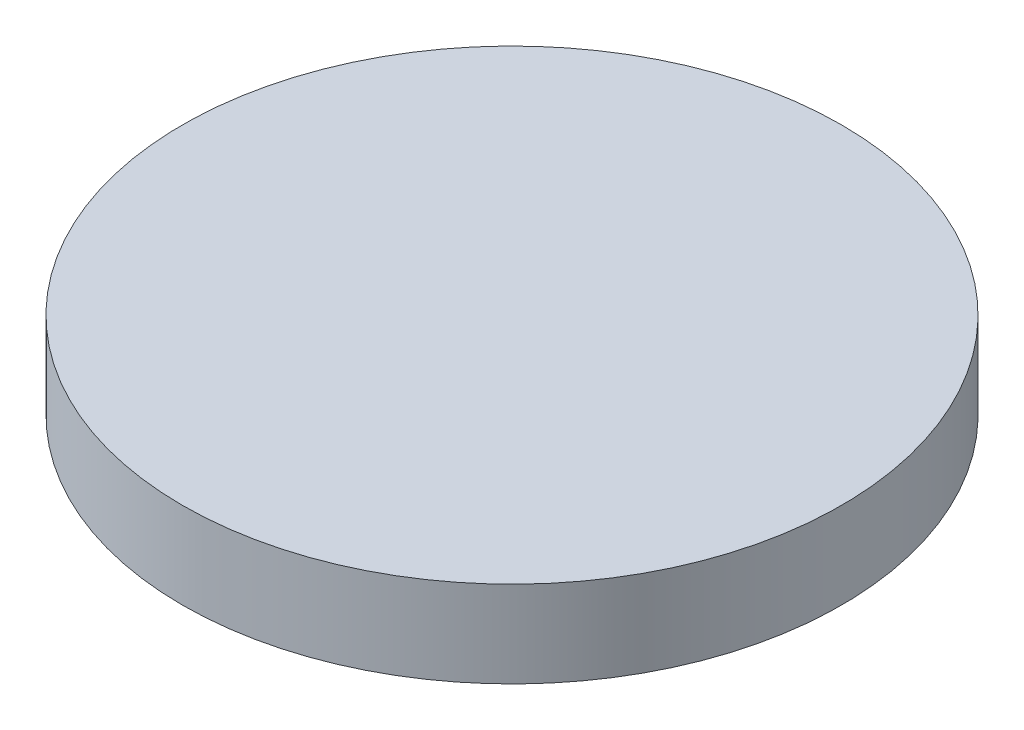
SolidWorks part; units mm, degrees
ref_plane "Спереди" through (0, 0, 0) normal (0, 0, 1) x (1, 0, 0)
ref_plane "Сверху" through (0, 0, 0) normal (0, 1, 0) x (1, 0, 0)
ref_plane "Справа" through (0, 0, 0) normal (1, 0, 0) x (0, 0, -1)
sketch "Эскиз1" plane through (0, 0, 0) normal (0, 1, 0) x (1, 0, 0)
  circle A0 centre (0, 0) radius 12.3031
  dimension "D1" = 24.6062
extrude "Бобышка-Вытянуть1" add sketch "Эскиз1" along normal blind 3.2258
